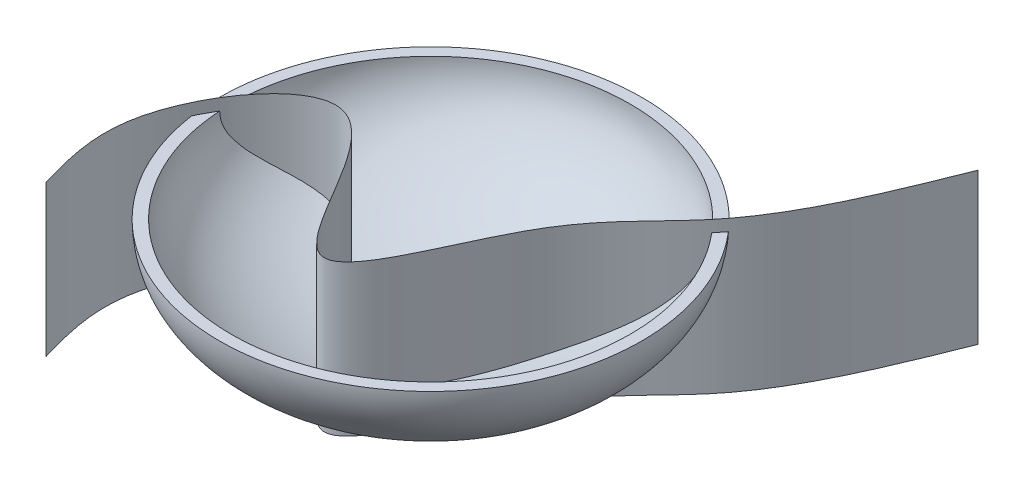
SolidWorks part; units mm, degrees
ref_plane "Ebene vorne" through (0, 0, 0) normal (0, 0, 1) x (1, 0, 0)
ref_plane "Ebene oben" through (0, 0, 0) normal (0, 1, 0) x (1, 0, 0)
ref_plane "Ebene rechts" through (0, 0, 0) normal (1, 0, 0) x (0, 0, -1)
sketch "Skizze1" plane through (0, 0, 0) normal (0, 0, 1) x (1, 0, 0)
  line L0 (-85.923, 0) -> (0, 0) construction
  line L1 (85.923, 0) -> (0, 0) construction
  line L2 (0, 0) -> (0, -51.8773) construction
  line L3 (-85.923, 0) -> (85.923, 0) construction
  line L4 (0, -46.8756) -> (0, -51.8773)
  line L5 (-85.923, 0) -> (-90.923, 0)
  ellipse E0 centre (0, 0) end of major axis (-85.923, 0) minor radius 46.8756 (-85.923, 0) -> (0, -46.8756) ccw
  spline S0 degree 1 poles (-90.923, 0) (0, -51.8756) knots 0 0 1 1 construction
  spline S1 degree 3 poles (-90.923, 0) (-90.923, -3.6774) (-89.5843, -10.9914) (-81.9882, -24.5502) (-68.1215, -35.7277) (-49.7443, -43.9451) (-34.1877, -48.4774) (-20.2023, -50.7898) (-8.7047, -51.7201) (-2.8978, -51.8756) (0, -51.8756) knots 0 0 0 0 0.19635 0.392699 0.785398 0.981748 1.178097 1.374447 1.472622 1.570796 1.570796 1.570796 1.570796
  dimension "D1" = 5
revolve "Rotation1" add sketch "Skizze1" angle 360 about L2
sketch "Skizze2" plane through (0, 0, 0) normal (0, 1, 0) x (1, 0, 0)
  circle A0 centre (0, 0) radius 85.923 construction
  spline S0 degree 3 poles (-91.5995, -74.1096) (-95.5102, -60.4035) (-105.032, -27.0323) (-47.523, 54.7935) (-4.2339, -86.5633) (26.6139, 20.4681) (76.0446, 59.3896) (93.6103, 103.5098) (104.6244, 131.1743) knots 0 0 0 0 0.112072 0.27287 0.472252 0.651579 0.78153 1 1 1 1
surface "Oberfläche-Linear austragen1" sketch "Skizze2" parameters "D1"=5, "D2"=60
split "Abspalten1" trimming surface bodies 103 bodies to split 102 resulting bodies 104 105
equation "\"LÄNGE\"=0"
equation "\"BREITE\"=0"
equation "\"HÖHE\"=0"
equation "\"DURCHMESSER\"=0"
equation "\"Stückzahl\"= 1"
